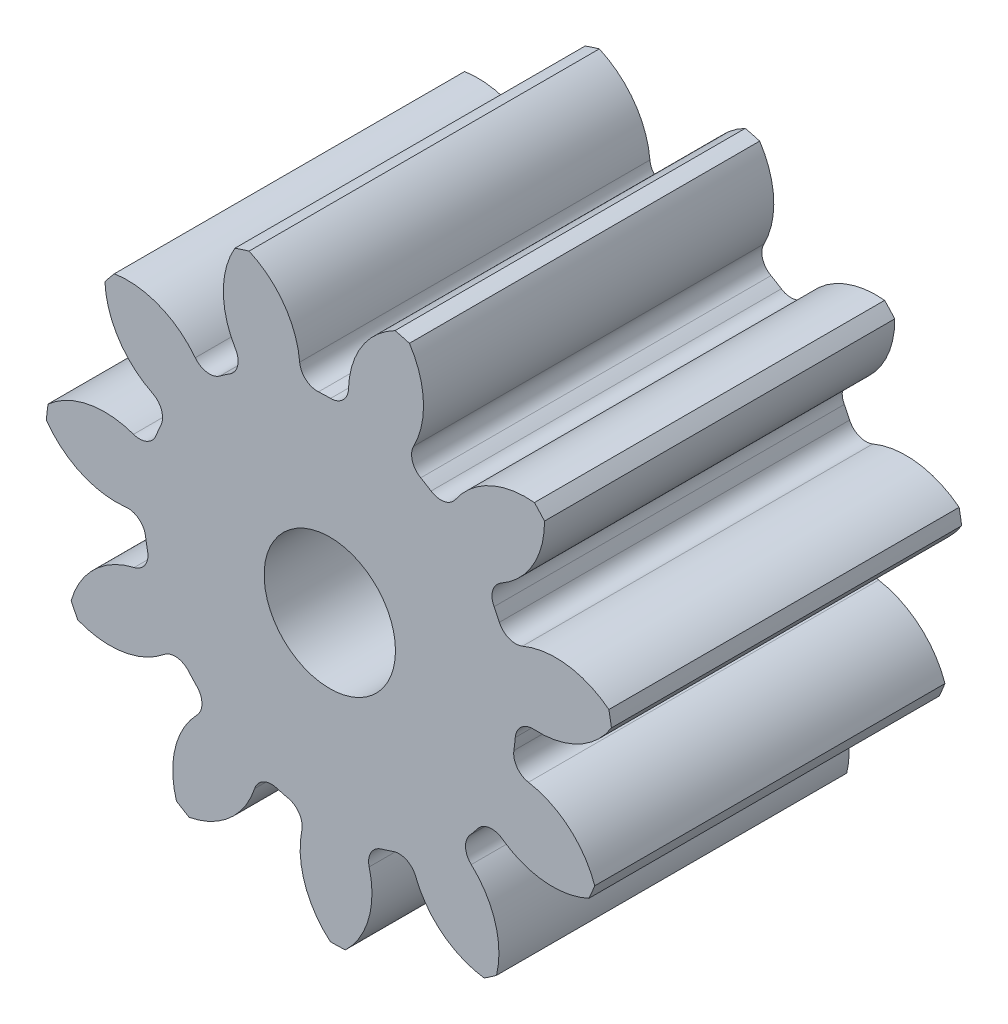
SolidWorks part; units mm, degrees
ref_plane "Front" through (0, 0, 0) normal (0, 0, 1) x (1, 0, 0)
ref_plane "Top" through (0, 0, 0) normal (0, 1, 0) x (1, 0, 0)
ref_plane "Right" through (0, 0, 0) normal (1, 0, 0) x (0, 0, -1)
sketch "Sketch3" plane through (0, 0, 0) normal (0, 0, 1) x (1, 0, 0)
  circle A0 centre (0, 0) radius 82.55
  dimension "od" = 165.1
extrude "gearBody" add sketch "Sketch3" along normal blind 101.6
sketch "Sketch2" plane through (0, 0, 0) normal (0, 0, 1) x (1, 0, 0)
  line L0 (0, 0) -> (60.6412, 25.1184) construction
  line L1 (77.3499, -31.7998) -> (0, 0) construction
  line L2 (0, 0) -> (36.3143, 0) construction
  line L3 (69.8204, 2.0335) -> (67.5351, -17.8336) construction
  line L5 (68.6777, -7.9001) -> (0, 0) construction
  line L7 (0, 0) -> (65.6375, 0) construction
  arc A0 (65.6329, 0.7822) -> (63.741, -15.6642) centre (0, 0) ccw construction
  arc A1 (81.6855, 11.9159) -> (76.8464, -30.1519) centre (0, 0) ccw construction
  arc A2 (69.8204, 2.0335) -> (67.5351, -17.8336) centre (0, 0) ccw construction
  arc A3 (53.3926, -7.9078) -> (53.7936, -4.422) centre (0, 0) ccw
  arc A4 (77.3499, -31.7998) -> (57.6184, -13.7572) centre (53.354, -38.2314) ccw
  arc A5 (77.3499, -31.7998) -> (82.55, 13.4063) centre (0, 0) ccw
  arc A6 (82.55, 13.4063) -> (59.2372, 0.3152) centre (60.6412, 25.1184) cw
  arc A7 (53.7936, -4.422) -> (59.2372, 0.3152) centre (58.9451, -4.8454) cw
  arc A8 (57.6184, -13.7572) -> (53.3926, -7.9078) centre (58.5057, -8.665) cw
  point P6 (82.55, 13.4063)
  point P22 (77.3499, -31.7998)
  dimension "baseDia" = 131.2751
  dimension "od" = 165.1
  dimension "pd" = 139.7
  dimension "rd" = 107.95
  dimension "rFillet" = 5.1689
  dimension "pointX" = 82.55
  dimension "pointY" = 13.4063
  dimension "CTT" = 19.8672
  dimension "flankCenterAngle" = 22.5
extrude "toothCut" cut sketch "Sketch2" along normal through all
pattern_circular "CirPattern1" count 11 over 360 about axis through (0, 0, 0) along (0, 0, 1) of "toothCut"
sketch "hub1Dia" plane through (0, 0, 0) normal (0, 0, -1) x (-1, 0, 0)
  circle A0 centre (0, 0) radius 12.7
  dimension "hub1Dia" = 25.4
sketch "hub2Dia" plane through (0, 0, 101.6) normal (0, 0, 1) x (1, 0, 0)
  circle A0 centre (0, 0) radius 12.7
  dimension "hub2dia" = 25.4
sketch "boreDia" plane through (0, 0, 0) normal (0, 0, 1) x (1, 0, 0)
  circle A0 centre (0, 0) radius 19.05
  dimension "boreDia" = 38.1
extrude "bore" cut sketch "boreDia" against normal mid plane 25400
